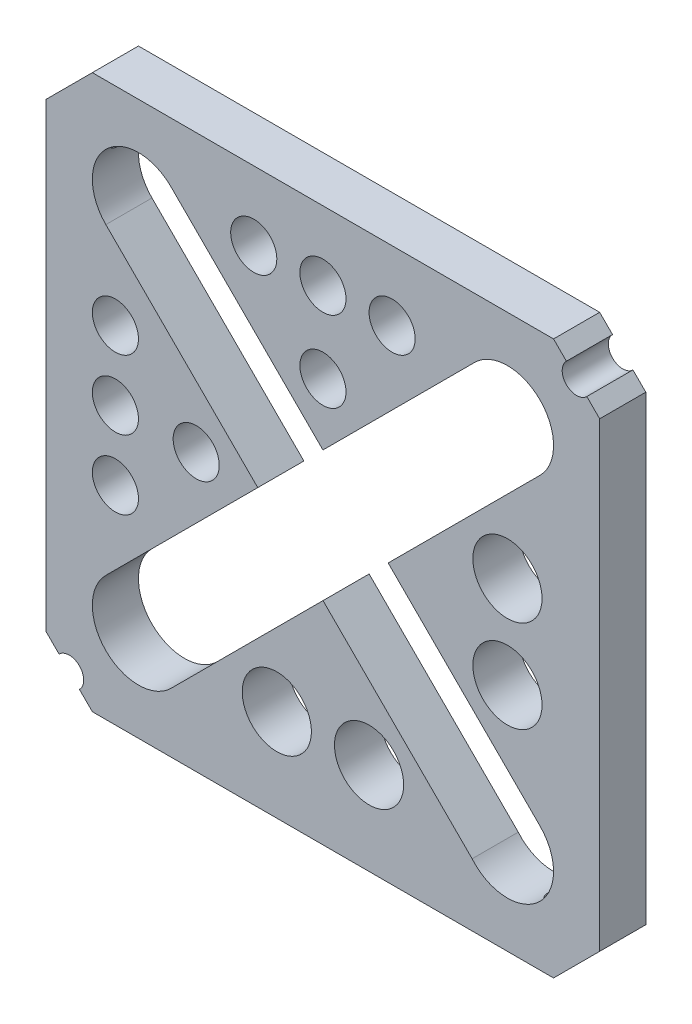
SolidWorks part; units mm, degrees
ref_plane "Front Plane" through (0, 0, 0) normal (0, 0, 1) x (1, 0, 0)
ref_plane "Top Plane" through (0, 0, 0) normal (0, 1, 0) x (1, 0, 0)
ref_plane "Right Plane" through (0, 0, 0) normal (1, 0, 0) x (0, 0, -1)
sketch "Sketch1" plane through (0, 0, 0) normal (0, 0, 1) x (1, 0, 0)
  line L0 (-38.1, 31.75) -> (-31.75, 38.1)
  line L1 (-31.75, -38.1) -> (31.75, -38.1)
  line L2 (-38.1, -31.75) -> (-38.1, 31.75)
  line L3 (-31.75, 38.1) -> (31.75, 38.1)
  line L4 (38.1, -31.75) -> (38.1, 31.75)
  line L5 (-33.5218, -33.5218) -> (33.5218, 33.5218) construction
  line L6 (-34.925, 34.925) -> (34.925, -34.925) construction
  line L7 (31.75, 38.1) -> (33.5218, 36.3282)
  line L8 (-38.1, -31.75) -> (-36.3282, -33.5218)
  line L9 (31.75, -38.1) -> (38.1, -31.75)
  line L10 (-33.5218, -36.3282) -> (-31.75, -38.1)
  line L11 (36.3282, 33.5218) -> (38.1, 31.75)
  arc A1 (33.5218, 36.3282) -> (36.3282, 33.5218) centre (34.925, 34.925) ccw
  arc A2 (-33.5218, -36.3282) -> (-36.3282, -33.5218) centre (-34.925, -34.925) ccw
  point P0 (0, 0)
  point P2 (0, 0)
  point P19 (0, 0)
  point P22 (0, 0)
  point P23 (0, 0)
  point P24 (0, 0)
  dimension "D11" = 3.9688
  dimension "D14" = 3.9688
  dimension "D2" = 63.5
  dimension "D3" = 63.5
  dimension "D4" = 63.5
  dimension "D5" = 63.5
  dimension "D6" = 8.9803
  dimension "D7" = 2.5058
  dimension "D8" = 2.5058
  dimension "D9" = 8.9803
  dimension "D10" = 2.5058
  dimension "D12" = 3.175
  dimension "D13" = 3.175
  dimension "D15" = 3.175
  dimension "D16" = 3.175
  dimension "D17" = 2.5058
extrude "Boss-Extrude1" add sketch "Sketch1" along normal blind 6.35
sketch "Sketch2" plane through (0, 0, 0) normal (0, 0, 1) x (1, 0, 0)
  line L0 (-31.75, -38.1) -> (31.75, -38.1) construction
  line L1 (-38.1, 31.75) -> (-38.1, -31.75) construction
  line L2 (38.1, -31.75) -> (38.1, 31.75) construction
  line L3 (31.75, 38.1) -> (-31.75, 38.1) construction
  line L4 (-29.8901, -20.9099) -> (-8.9733, 0.0069)
  line L5 (29.8901, 20.9099) -> (8.9803, 0)
  line L8 (29.8901, -20.9099) -> (8.9803, 0)
  line L10 (20.5395, -29.4863) -> (0.0099, -8.9703)
  line L11 (-8.9733, 0.0069) -> (-29.8901, 20.9099)
  line L12 (0, 8.9803) -> (20.9099, 29.8901)
  line L13 (0, 8.9803) -> (-20.9099, 29.8901)
  line L14 (0.0099, -8.9703) -> (-20.9099, -29.8901)
  circle A0 centre (-28.575, -9.525) radius 3.175
  circle A1 centre (-28.575, 0) radius 3.175
  circle A2 centre (-28.575, 9.525) radius 3.175
  circle A3 centre (-17.4498, 0) radius 3.175
  circle A4 centre (-9.525, 28.575) radius 3.175
  circle A5 centre (0, 28.575) radius 3.175
  circle A6 centre (9.525, 28.575) radius 3.175
  circle A7 centre (0, 17.4752) radius 3.175
  circle A8 centre (-6.35, -25.4) radius 4.7625
  circle A9 centre (6.35, -25.4) radius 4.7625
  circle A10 centre (25.4, -6.35) radius 4.7625
  circle A11 centre (25.4, 6.35) radius 4.7625
  arc A12 (-20.9099, 29.8901) -> (-29.8871, 20.9069) centre (-25.4, 25.4) ccw
  arc A13 (29.8901, 20.9099) -> (20.9099, 29.8901) centre (25.4, 25.4) ccw
  arc A14 (20.5395, -29.4863) -> (29.8901, -20.9099) centre (25.4, -25.4) ccw
  arc A15 (-29.8901, -20.9099) -> (-20.9099, -29.8901) centre (-25.4, -25.4) ccw
  point P44 (29.8901, -20.9099)
  point P47 (20.9305, -29.9107)
  point P48 (20.9356, -29.9157)
  point P49 (20.9356, -29.9157)
  point P50 (0, 0)
  point P51 (0, 0)
  point P52 (20.9356, -29.9157)
  point P53 (0, 0)
  point P54 (0, 0)
  point P55 (20.3971, -29.3107)
  point P56 (-29.8901, 20.9099)
  point P57 (0, 0)
  dimension "D1" = 6.35
  dimension "D6" = 6.35
  dimension "D7" = 6.35
  dimension "D8" = 6.35
  dimension "D9" = 6.35
  dimension "D10" = 6.35
  dimension "D11" = 6.35
  dimension "D12" = 6.35
  dimension "D25" = 9.525
  dimension "D26" = 9.525
  dimension "D27" = 9.525
  dimension "D28" = 9.525
  dimension "D37" = 12.7
  dimension "D38" = 12.7
  dimension "D39" = 12.7
  dimension "D40" = 12.7
  dimension "D2" = 28.575
  dimension "D3" = 9.525
  dimension "D4" = 9.525
  dimension "D5" = 38.1
  dimension "D13" = 9.525
  dimension "D14" = 47.625
  dimension "D15" = 20.6502
  dimension "D16" = 38.1
  dimension "D17" = 38.1
  dimension "D18" = 55.5752
  dimension "D19" = 66.675
  dimension "D20" = 66.675
  dimension "D21" = 66.675
  dimension "D22" = 28.575
  dimension "D23" = 38.1
  dimension "D24" = 47.625
  dimension "D29" = 31.75
  dimension "D30" = 44.45
  dimension "D31" = 12.7
  dimension "D32" = 12.7
  dimension "D33" = 31.75
  dimension "D34" = 44.45
  dimension "D35" = 63.5
  dimension "D36" = 63.5
  dimension "D41" = 12.7
  dimension "D42" = 12.7
  dimension "D43" = 12.7
  dimension "D44" = 12.7
  dimension "D45" = 12.7
  dimension "D46" = 12.7
  dimension "D47" = 12.7
  dimension "D48" = 12.7
  dimension "D49" = 12.7
extrude "Cut-Extrude1" cut sketch "Sketch2" along normal blind 17.272 and the other way blind 9.144 contours L4 A15 L14 L10 A14 L8 L5 A13 L12 L13 A12 L11 | A11 | A10 | A9 | A8 | A0 | A3 | A2 | A1 | A7 | A6 | A5 | A4
sketch "Sketch4" plane through (34.925, -34.925, 0) normal (0.7071, -0.7071, 0) x (0, 0, -1)
  line L0 (-6.35, 4.4901) -> (0, 4.4901) construction
  line L1 (-6.35, -4.4901) -> (-6.35, 4.4901) construction
  circle A0 centre (-3.175, 0) radius 2.0828
  dimension "D1" = 4.1656
  dimension "D2" = 3.175
  dimension "D3" = 4.4901
extrude "Cut-Extrude2" cut sketch "Sketch4" against normal through all both and the other way through all
